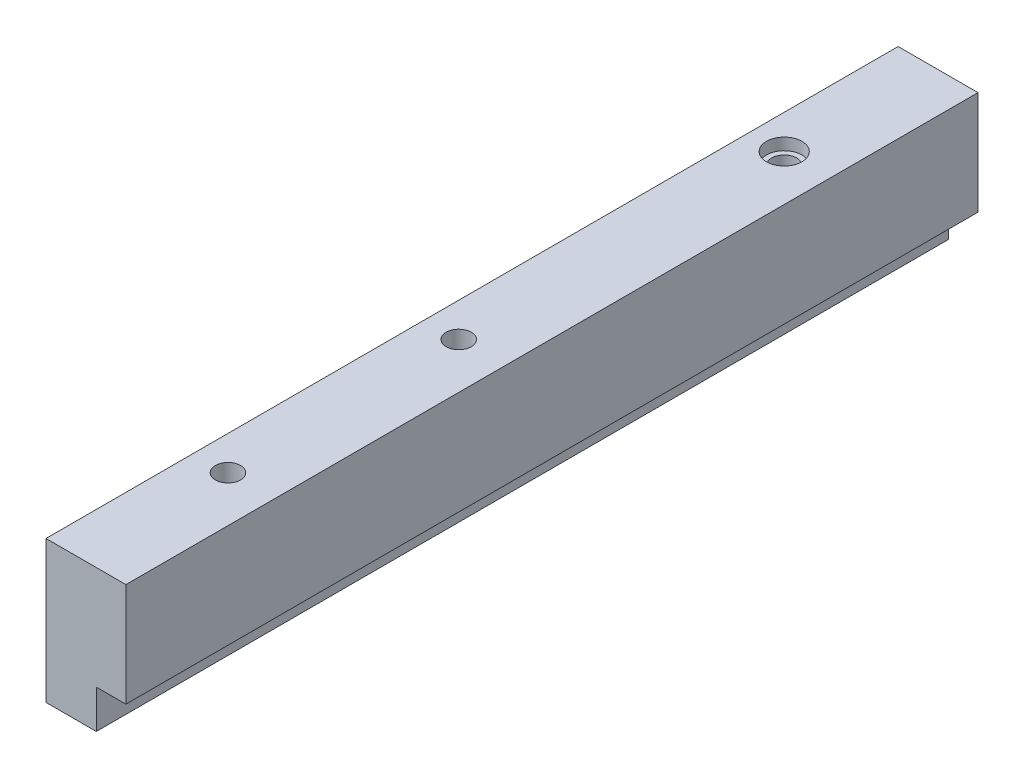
SolidWorks part; units mm, degrees
ref_plane "Plane1" through (0, 0, 0) normal (0, 0, 1) x (1, 0, 0)
ref_plane "Plane2" through (0, 0, 0) normal (0, 1, 0) x (1, 0, 0)
ref_plane "Plane3" through (0, 0, 0) normal (1, 0, 0) x (0, 0, -1)
sketch "Sketch1" plane through (0, 0, 0) normal (0, 0, 1) x (1, 0, 0)
  line L2 (122.2375, -79.375) -> (95.25, -79.375)
  line L3 (122.2375, -79.375) -> (122.2375, -58.7375)
  line L4 (122.2375, -58.7375) -> (138.1125, -58.7375)
  line L5 (138.1125, -58.7375) -> (138.1125, -3.175)
  line L6 (138.1125, -3.175) -> (95.25, -3.175)
  line L7 (95.25, -3.175) -> (95.25, -79.375)
  dimension "halfW" = 138.1125
  dimension "D3" = 20.6375
  dimension "P" = 42.8625
  dimension "C" = 76.2
extrude "Base-Extrude" add sketch "Sketch1" along normal mid plane 457.2
other "Hole1"
sketch "H1ctrl" plane through (0, -79.375, 0) normal (0, -1, 0) x (1, 0, 0)
  circle A0 centre (113.5062, -149.225) radius 6.7437
  dimension "Diameter" = 13.4874
other "TB1" parameters "D1"=6.35
sketch "TB1ext" plane through (0, -3.175, 0) normal (0, 1, 0) x (-1, 0, 0)
  circle A0 centre (-113.5062, -149.225) radius 9.525
  circle A2 centre (-113.5062, -149.225) radius 6.7437 construction
sketch "H2ctrl" plane through (-1.797, -79.375, 52.6741) normal (0, -1, 0) x (1, 0, 0)
  circle A0 centre (115.3032, 96.5509) radius 6.7469
other "Hole2"
sketch "H6ctrl" plane through (-4.6192, -79.375, 63.5331) normal (0, -1, 0) x (1, 0, 0)
  circle A0 centre (118.1254, -38.1331) radius 6.7469
  dimension "Diameter" = 13.4937
  dimension "hole3Y" = 25.4
other "Hole3"
hole_wizard "Tap1" positions "Tap2ctrl" profile "Sketch10"
sketch "Tap2ctrl" plane through (0, -79.375, 0) normal (0, -1, 0) x (1, 0, 0)
  point P0 (113.5062, -212.725)
  dimension "TapX" = 113.5063
sketch "Sketch10" plane through (113.5062, -79.375, -212.725) normal (1, 0, 0) x (0, 0, -1)
  line L0 (0, 0) -> (0, 26.9875)
  line L1 (0, 26.9875) -> (5.3467, 24.6028)
  line L2 (5.3467, 24.6028) -> (5.3467, 0.0025)
  line L3 (5.3467, 0.0025) -> (5.3467, 0)
  line L4 (5.3467, 0) -> (0, 0)
hole_wizard "DowelHole1" positions "DP1ctrl" profile "Sketch13" legacy
sketch "DP1ctrl" plane through (0, -79.375, 0) normal (0, -1, 0) x (1, 0, 0)
  line L0 (50, 0) -> (-50, 0) construction
  line L1 (0, -50) -> (0, 50) construction
  point P0 (113.5063, -180.975)
  dimension "DPx" = 113.5063
sketch "Sketch13" plane through (113.5062, -79.375, -180.975) normal (1, 0, 0) x (0, 0, -1)
  line L0 (0, 0) -> (0, 29.2154)
  line L1 (0, 29.2154) -> (6.35, 25.4)
  line L2 (6.35, 25.4) -> (6.35, 0.1905)
  line L3 (6.35, 0.1905) -> (6.5405, 0)
  line L5 (6.5405, 0) -> (0, 0)
  line L6 (-6.35, 0.1905) -> (-6.5405, 0) construction
  line L10 (0, 29.2154) -> (-6.35, 25.4) construction
  line L11 (0, -6.35) -> (0, 107.95) construction
mirror "Mirror4" about plane through (0, 0, 0) normal (0, 0, 1) of "DowelHole1", "Tap1"
